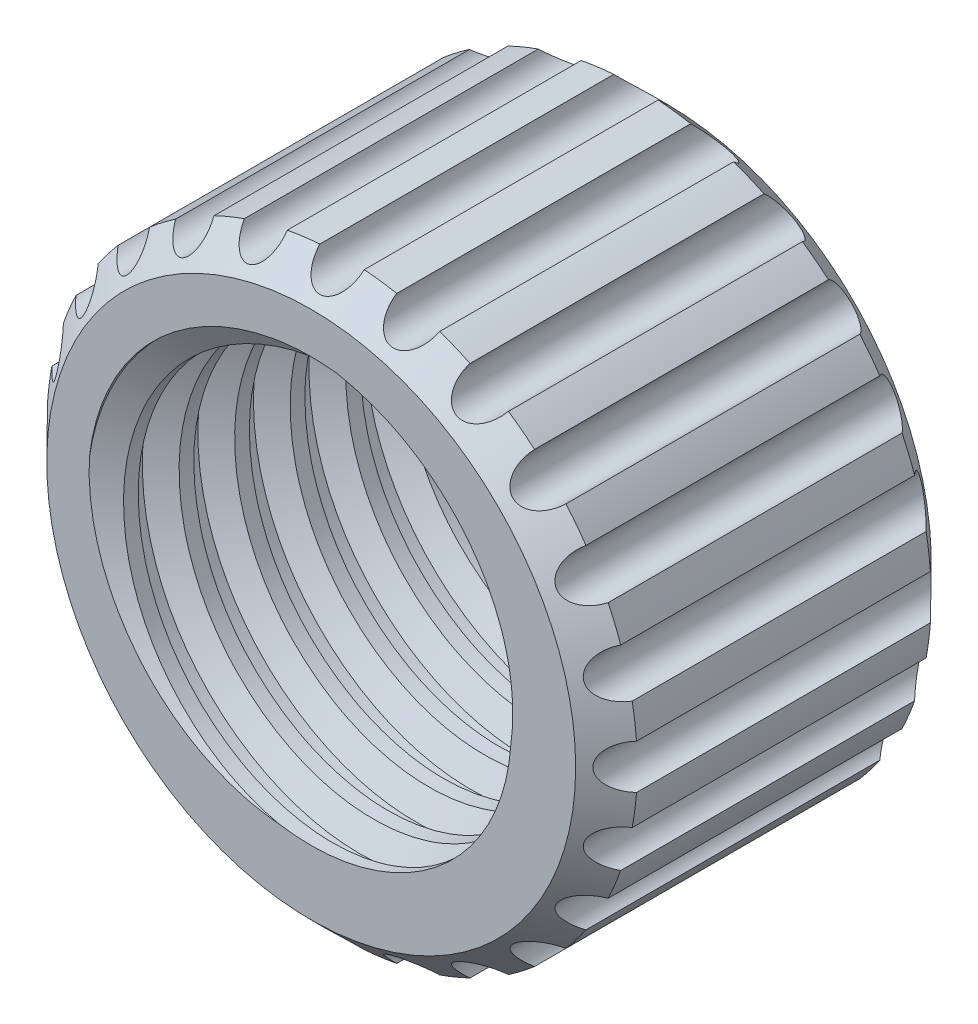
SolidWorks part; units mm, degrees
ref_plane "Front Plane" through (0, 0, 0) normal (0, 0, 1) x (1, 0, 0)
ref_plane "Top Plane" through (0, 0, 0) normal (0, 1, 0) x (1, 0, 0)
ref_plane "Right Plane" through (0, 0, 0) normal (1, 0, 0) x (0, 0, -1)
sketch "Sketch1" plane through (0, 0, 0) normal (0, 0, 1) x (1, 0, 0)
  circle A0 centre (0, 0) radius 7.3025
  circle A1 centre (0, 0) radius 5.5225
  dimension "D1" = 14.605
  dimension "D2" = 11.045
extrude "Boss-Extrude1" add sketch "Sketch1" along normal blind 18.2245
sketch "Sketch2" plane through (0, 0, 18.2245) normal (0, 0, 1) x (1, 0, 0)
  circle A0 centre (0, 0) radius 5.5225
  circle A1 centre (0, 0) radius 7.9375
  circle A2 centre (0, 0) radius 5.5225 construction
  dimension "D1" = 15.875
extrude "Boss-Extrude2" add sketch "Sketch2" against normal up to surface (18.2245 mm away)
thread "Thread1" pitch 1.5875 start angle 0, offset 1.5875, length 20.32, pitch 1.5875, diameter 11.045
ref_plane "Plane1" through (5.5225, 0, -1.5875) normal (0, 1, 0) x (-1, 0, 0)
sketch "Thread Profile1" plane through (5.5225, 0, -1.5875) normal (0, 1, 0) x (-1, 0, 0)
  line L0 (0, 0) -> (0, 1.5875) construction
  line L11 (0, 0) -> (0, 1.3891)
  line L12 (0, 1.3891) -> (-0.8593, 0.893)
  line L13 (-0.8593, 0.893) -> (-0.8593, 0.4961)
  line L15 (-0.8593, 0.4961) -> (0, 0)
  line L17 (-0.8593, 0.6945) -> (0, 0.6945) construction
  point P2 (0, 0)
  dimension "Pitch" = 1.5875
  dimension "Profile_Angle" = 60
  dimension "Profile_Land" = 0.3969
  dimension "Profile_Height" = 0.8593
move or copy body "Body-Move/Copy1" bodies to move or copy 103 copy no rotation origin (0, 0, 6.3512) rotation axis (1, 0, 0) rotation angle 180
sketch "Sketch3" plane through (0, 0, 12.7023) normal (0, 0, 1) x (1, 0, 0)
  circle A0 centre (0, 0) radius 7.9375
  circle A1 centre (0, 0) radius 7.9375 construction
extrude "Cut-Extrude1" cut sketch "Sketch3" against normal blind 8.0645
sketch "Sketch6" plane through (0, 0, -5.5222) normal (0, 0, -1) x (-1, 0, 0)
  circle A0 centre (0, 0) radius 7.9375
  circle A1 centre (0, 0) radius 8.4375
  circle A2 centre (0, 0) radius 7.9375 construction
  dimension "D1" = 0.5
extrude "Boss-Extrude3" add sketch "Sketch6" against normal up to surface (10.16 mm away)
sketch "Sketch4" plane through (0, 0, 4.6378) normal (0, 0, 1) x (1, 0, 0)
  circle A25 centre (0, -8.4375) radius 0.635
  circle A26 centre (0, 0) radius 8.4375 construction
  circle A27 centre (-2.1838, -8.15) radius 0.635
  circle A28 centre (-4.2188, -7.3071) radius 0.635
  circle A29 centre (-5.9662, -5.9662) radius 0.635
  circle A30 centre (-7.3071, -4.2188) radius 0.635
  circle A31 centre (-8.15, -2.1838) radius 0.635
  circle A32 centre (-8.4375, 0) radius 0.635
  circle A33 centre (-8.15, 2.1838) radius 0.635
  circle A34 centre (-7.3071, 4.2188) radius 0.635
  circle A35 centre (-5.9662, 5.9662) radius 0.635
  circle A36 centre (-4.2187, 7.3071) radius 0.635
  circle A37 centre (-2.1838, 8.15) radius 0.635
  circle A38 centre (0, 8.4375) radius 0.635
  circle A39 centre (2.1838, 8.15) radius 0.635
  circle A40 centre (4.2188, 7.3071) radius 0.635
  circle A41 centre (5.9662, 5.9662) radius 0.635
  circle A42 centre (7.3071, 4.2187) radius 0.635
  circle A43 centre (8.15, 2.1838) radius 0.635
  circle A44 centre (8.4375, 0) radius 0.635
  circle A45 centre (8.15, -2.1838) radius 0.635
  circle A46 centre (7.3071, -4.2188) radius 0.635
  circle A47 centre (5.9662, -5.9662) radius 0.635
  circle A48 centre (4.2187, -7.3071) radius 0.635
  circle A49 centre (2.1838, -8.15) radius 0.635
  point P4 (0, 8.4375)
  point P54 (0, 0)
  dimension "D1" = 1.27
extrude "Cut-Extrude2" cut sketch "Sketch4" against normal through all both and the other way through all
sketch "Sketch7" plane through (0, 0, 0) normal (1, 0, 0) x (0, 0, -1)
  line L0 (5.5222, -0.6346) -> (5.5222, 0.6346) construction
  line L2 (-4.6378, 0.6346) -> (-4.6378, -0.6346) construction
  line L3 (5.5222, 0) -> (-4.6378, 0) construction
  line L4 (0.4422, 0) -> (0.4422, -8.509) construction
  line L14 (4.5697, -8.509) -> (-3.6853, -8.509) construction
  line L18 (-3.6853, -8.509) -> (-6.2253, -5.969)
  line L19 (-6.2253, -5.969) -> (-6.2253, -8.509)
  line L20 (-6.2253, -8.509) -> (-3.6853, -8.509)
  line L21 (4.5697, -8.509) -> (7.1097, -5.969)
  line L22 (7.1097, -5.969) -> (7.1097, -8.509)
  line L23 (7.1097, -8.509) -> (4.5697, -8.509)
  point P0 (5.5222, 0)
  point P1 (-4.6378, 0)
  point P14 (0.4422, -8.509)
  point P16 (0.4422, 0)
  point P18 (0.4422, 0)
  dimension "D1" = 8.509
  dimension "D2" = 2.54
  dimension "D3" = 8.255
revolve "Cut-Revolve1" cut sketch "Sketch7" angle 360 about L3
sketch "Sketch8" plane through (0, 0, -5.5222) normal (0, 0, -1) x (-1, 0, 0)
  circle A0 centre (0, 0) radius 5.715
  dimension "D1" = 11.43
extrude "Cut-Extrude3" cut sketch "Sketch8" against normal through all both and the other way through all
